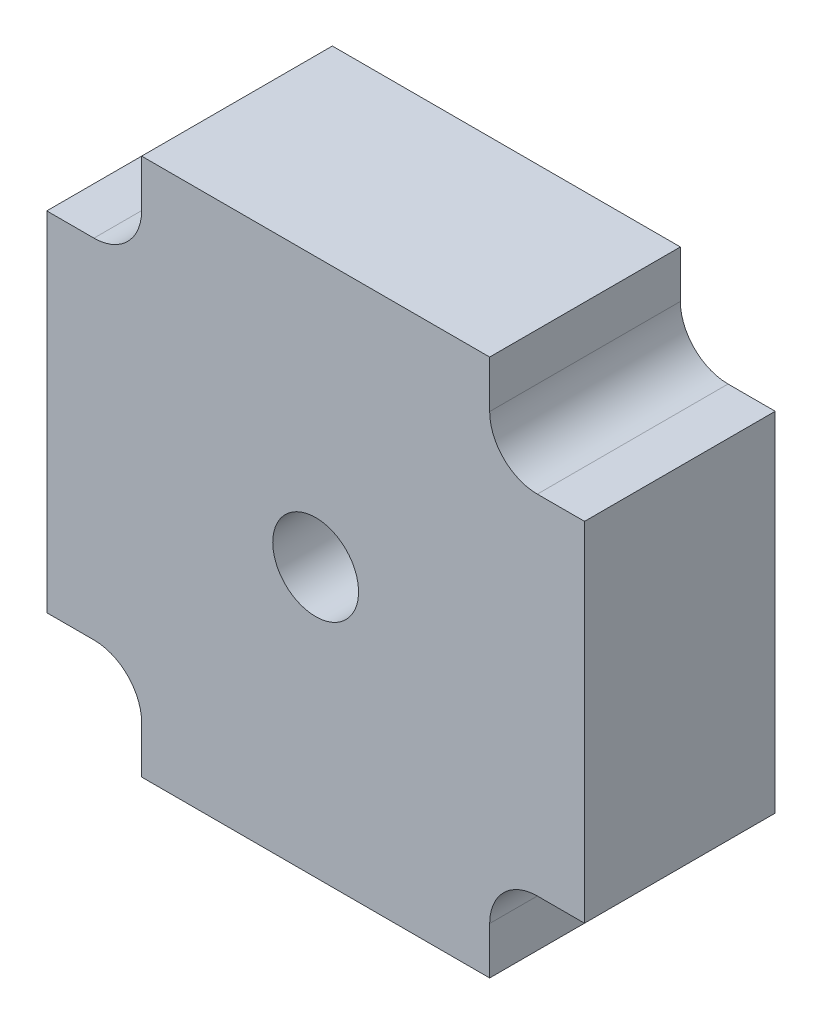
SolidWorks part; units mm, degrees
ref_plane "前视" through (0, 0, 0) normal (0, 0, 1) x (1, 0, 0)
ref_plane "上视" through (0, 0, 0) normal (0, 1, 0) x (1, 0, 0)
ref_plane "右视" through (0, 0, 0) normal (1, 0, 0) x (0, 0, -1)
sketch "草图1" plane through (0, 0, 0) normal (0, 0, 1) x (1, 0, 0)
  line L0 (-18.25, 18.25) -> (-28.2, 18.25)
  line L1 (18.25, -28.2) -> (-18.25, -28.2)
  line L2 (28.2, -18.25) -> (28.2, 18.25)
  line L3 (18.25, 28.2) -> (-18.25, 28.2)
  line L4 (-28.2, -18.25) -> (-28.2, 18.25)
  line L5 (28.2, -28.2) -> (18.25, -18.25) construction
  line L6 (28.2, 28.2) -> (-28.2, -28.2) construction
  line L7 (28.2, -18.25) -> (18.25, -18.25)
  line L8 (-18.25, 18.25) -> (-28.2, 28.2) construction
  line L9 (28.2, 18.25) -> (18.25, 18.25)
  line L14 (18.25, -28.2) -> (18.25, -18.25)
  line L16 (-18.25, -28.2) -> (-18.25, -18.25)
  line L19 (-18.25, 18.25) -> (-18.25, 28.2)
  line L20 (-18.25, -18.25) -> (-28.2, -18.25)
  line L21 (18.25, 18.25) -> (18.25, 28.2)
  point P0 (0, 0)
  point P6 (0, 0)
  point P11 (0, 0)
  dimension "D1" = 56.4
  dimension "D2" = 56.4
  dimension "D3" = 36.5
  dimension "D4" = 36.5
extrude "凸台-拉伸1" add sketch "草图1" along normal blind 20
sketch "草图2" plane through (0, 0, 0) normal (0, 0, -1) x (-1, 0, 0)
  circle A0 centre (0, 0) radius 4.5
extrude "切除-拉伸1" cut sketch "草图2" against normal blind 20
fillet "圆角1" radius 5 4 edges at (18.25, -18.25, 10) (-18.25, -18.25, 10) (-18.25, 18.25, 10) (18.25, 18.25, 10)
